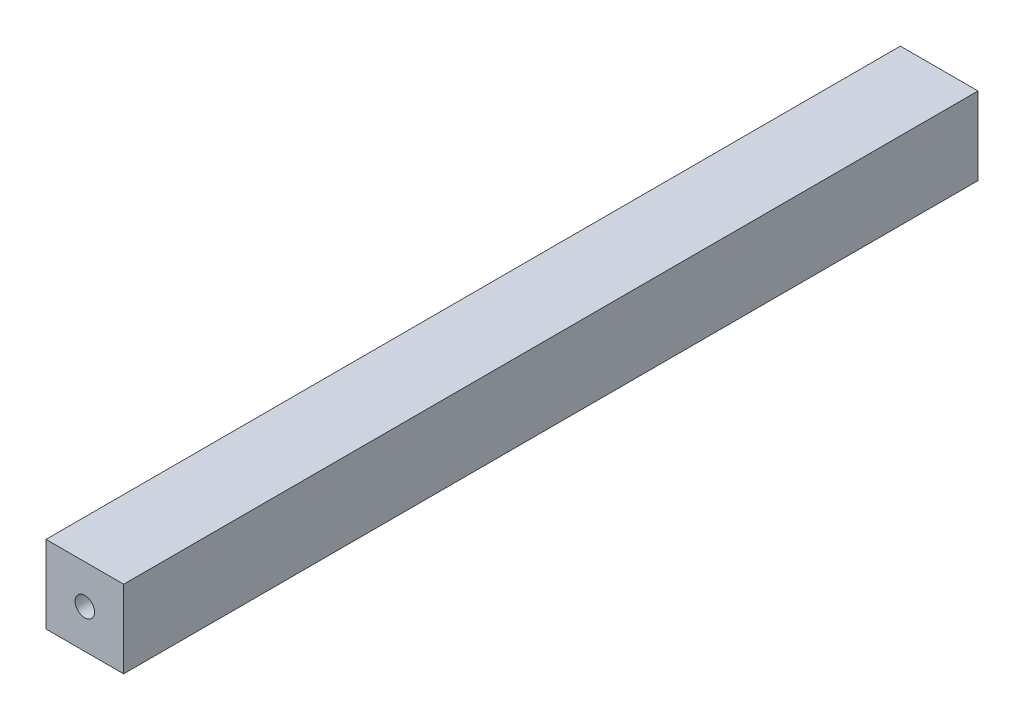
SolidWorks part; units mm, degrees
ref_plane "Face" through (0, 0, 0) normal (0, 0, 1) x (1, 0, 0)
ref_plane "Dessus" through (0, 0, 0) normal (0, 1, 0) x (1, 0, 0)
ref_plane "Droite" through (0, 0, 0) normal (1, 0, 0) x (0, 0, -1)
sketch "Esquisse1" plane through (0, 0, 0) normal (0, 0, 1) x (1, 0, 0)
  line L1 (-22.3799, -10) -> (-12.3799, -10)
  line L2 (-22.3799, -10) -> (-22.3799, -20)
  line L3 (-22.3799, -20) -> (-12.3799, -20)
  line L4 (-12.3799, -10) -> (-12.3799, -20)
  circle A0 centre (-17.3799, -15) radius 1.25
  dimension "D3" = 5
  dimension "D1" = 10
  dimension "D2" = 10
  dimension "D4" = 5
extrude "Base-Extrusion" add sketch "Esquisse1" along normal blind 110
